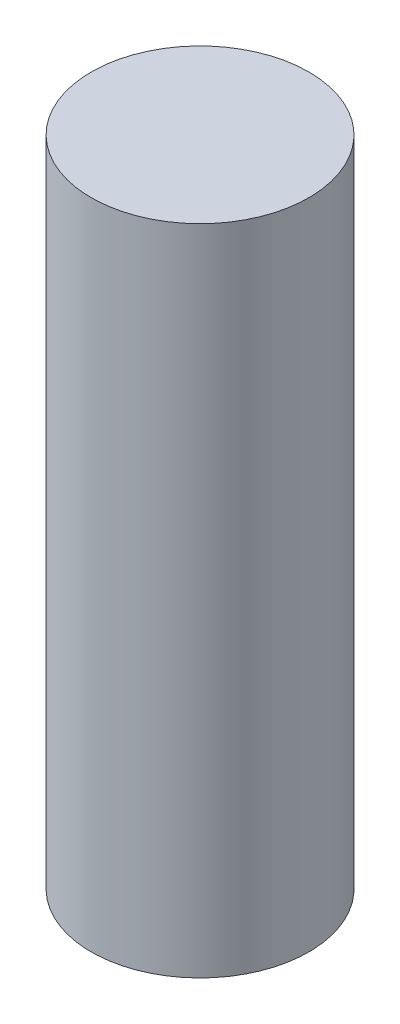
SolidWorks part; units mm, degrees
ref_plane "Plan de face" through (0, 0, 0) normal (0, 0, 1) x (1, 0, 0)
ref_plane "Plan de dessus" through (0, 0, 0) normal (0, 1, 0) x (1, 0, 0)
ref_plane "Plan de droite" through (0, 0, 0) normal (1, 0, 0) x (0, 0, -1)
sketch "Esquisse1" plane through (0, 0, 0) normal (0, 0, 1) x (1, 0, 0)
  line L0 (0, -12.8971) -> (0, 38.1539) construction
  line L2 (0, 0) -> (-5, 0)
  line L3 (0, 0) -> (0, 30)
  line L4 (0, 30) -> (-5, 30)
  line L5 (-5, 0) -> (-5, 30)
  dimension "D1" = 30
  dimension "D2" = 10
revolve "Révolution1" add sketch "Esquisse1" angle 360 about L0
